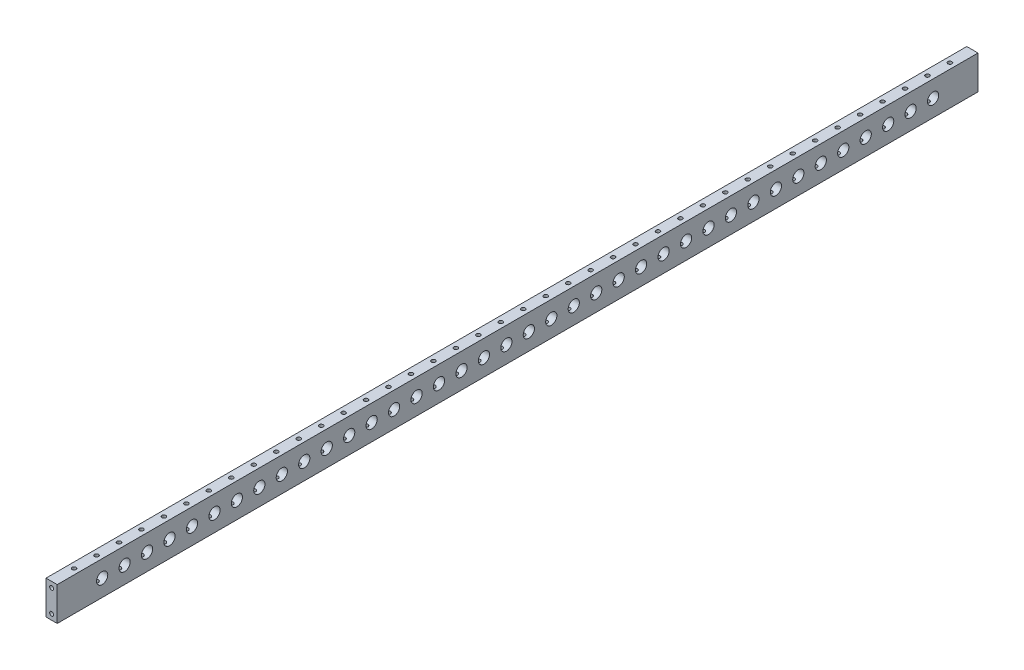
SolidWorks part; units mm, degrees
ref_plane "Front" through (0, 0, 0) normal (0, 0, 1) x (1, 0, 0)
ref_plane "Top" through (0, 0, 0) normal (0, 1, 0) x (1, 0, 0)
ref_plane "Right" through (0, 0, 0) normal (1, 0, 0) x (0, 0, -1)
sketch "Sketch1" plane through (0, 0, 0) normal (0, 0, 1) x (1, 0, 0)
  line L1 (0, 0) -> (6.35, 0)
  line L2 (0, 0) -> (0, 19.05)
  line L3 (0, 19.05) -> (6.35, 19.05)
  line L4 (6.35, 0) -> (6.35, 19.05)
  dimension "D1" = 19.05
  dimension "D2" = 6.35
extrude "rail" add sketch "Sketch1" against normal blind 520.7
sketch "Sketch2" plane through (0, 0, 0) normal (0, 0, 1) x (1, 0, 0)
  line L0 (3.175, 19.05) -> (3.175, -0.2378) construction
  line L1 (6.35, 19.05) -> (0, 19.05) construction
  circle A0 centre (3.175, 15.875) radius 1.1303
  circle A1 centre (3.175, 3.175) radius 1.1303
  dimension "D2" = 12.7
  dimension "D3" = 2.2606
  dimension "D4" = 2.2606
  dimension "D1" = 3.175
extrude "L end holes" cut sketch "Sketch2" against normal blind 12.7
sketch "Sketch3" plane through (0, 0, -520.7) normal (0, 0, -1) x (-1, 0, 0)
  circle A0 centre (-3.175, 3.175) radius 1.1303 construction
  circle A1 centre (-3.175, 15.875) radius 1.1303 construction
  circle A2 centre (-3.175, 3.175) radius 1.1303
  circle A3 centre (-3.175, 15.875) radius 1.1303
extrude "rt end holes" cut sketch "Sketch3" against normal blind 12.7
sketch "Sketch4" plane through (6.35, 0, 0) normal (1, 0, 0) x (0, 0, -1)
  line L0 (-8.8855, 9.525) -> (70.8606, 9.525) construction
  line L1 (520.7, 0) -> (0, 0) construction
  line L2 (0, 0) -> (0, 19.05) construction
  circle A0 centre (25.4, 9.525) radius 3.175
  dimension "D3" = 6.35
  dimension "D1" = 9.525
  dimension "D2" = 25.4
extrude ".25 in holes" cut sketch "Sketch4" against normal through all
pattern_linear "LPattern1" count 38 spacing 12.7 along (0, 0, -1) of ".25 in holes"
sketch "Sketch5" plane through (0, 19.05, 0) normal (0, 1, 0) x (-1, 0, 0)
  line L0 (-3.175, 6.1627) -> (-3.175, -27.1753) construction
  line L1 (-3.175, -12.7) -> (-3.175, 0) construction
  line L3 (-6.35, 0) -> (0, 0) construction
  circle A0 centre (-3.175, -25.4) radius 1.1303
  dimension "D1" = 25.4
  dimension "D2" = 2.2606
extrude "Cut-Extrude4" cut sketch "Sketch5" against normal through all
pattern_linear "LPattern2" count 39 spacing 12.7 along (0, 0, -1) of "Cut-Extrude4"
sketch "Sketch6" plane through (0, 19.05, 0) normal (0, 1, 0) x (-1, 0, 0)
  line L0 (-3.175, -25.4) -> (-3.175, 5.2727) construction
  line L2 (-3.175, -12.7) -> (-3.175, 0) construction
  circle A0 centre (-3.175, -12.7) radius 1.1303
  circle A1 centre (-3.175, -25.4) radius 1.1303 construction
  dimension "D1" = 12.7
  dimension "D2" = 2.2606
extrude "Cut-Extrude5" cut sketch "Sketch6" against normal through all
